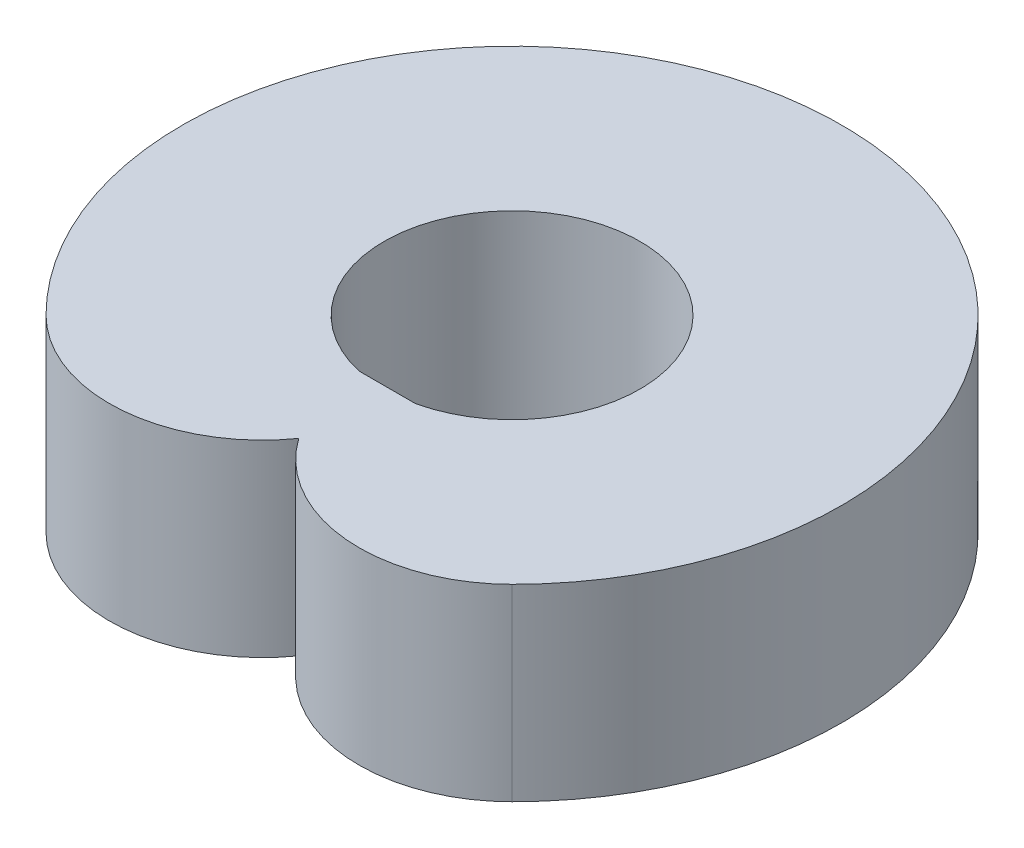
SolidWorks part; units mm, degrees
ref_plane "前视基准面" through (0, 0, 0) normal (0, 0, 1) x (1, 0, 0)
ref_plane "上视基准面" through (0, 0, 0) normal (0, 1, 0) x (1, 0, 0)
ref_plane "右视基准面" through (0, 0, 0) normal (1, 0, 0) x (0, 0, -1)
sketch "草图1" plane through (0, 0, 0) normal (0, 1, 0) x (1, 0, 0)
  line L0 (0, 0) -> (0, 825) construction
  line L1 (0, 0) -> (-494.9747, -494.9747) construction
  line L2 (0, 0) -> (494.9747, -494.9747) construction
  line L3 (0, 375) -> (229.8097, 145.1903) construction
  line L4 (0, 375) -> (-229.8097, 145.1903) construction
  line L5 (59.835, -265.165) -> (-59.835, -265.165)
  circle A0 centre (0, 0) radius 375 construction
  circle A1 centre (0, 375) radius 325 construction
  arc A2 (494.9747, -494.9747) -> (-494.9747, -494.9747) centre (0, 0) ccw
  arc A4 (-494.9747, -494.9747) -> (0, -453.0812) centre (-265.165, -265.165) ccw
  arc A5 (0, -453.0812) -> (494.9747, -494.9747) centre (265.165, -265.165) ccw
  arc A7 (59.835, -265.165) -> (-59.835, -265.165) centre (0, 0) ccw
  point P19 (0, -299)
  dimension "D1" = 750
  dimension "D2" = 650
  dimension "D4" = 135
  dimension "D3" = 700
  dimension "D8" = 325
  dimension "D5" = 135
  dimension "D6" = 135
  dimension "D7" = 135
  dimension "D9" = 135
extrude "凸台-拉伸1" add sketch "草图1" along normal blind 400
